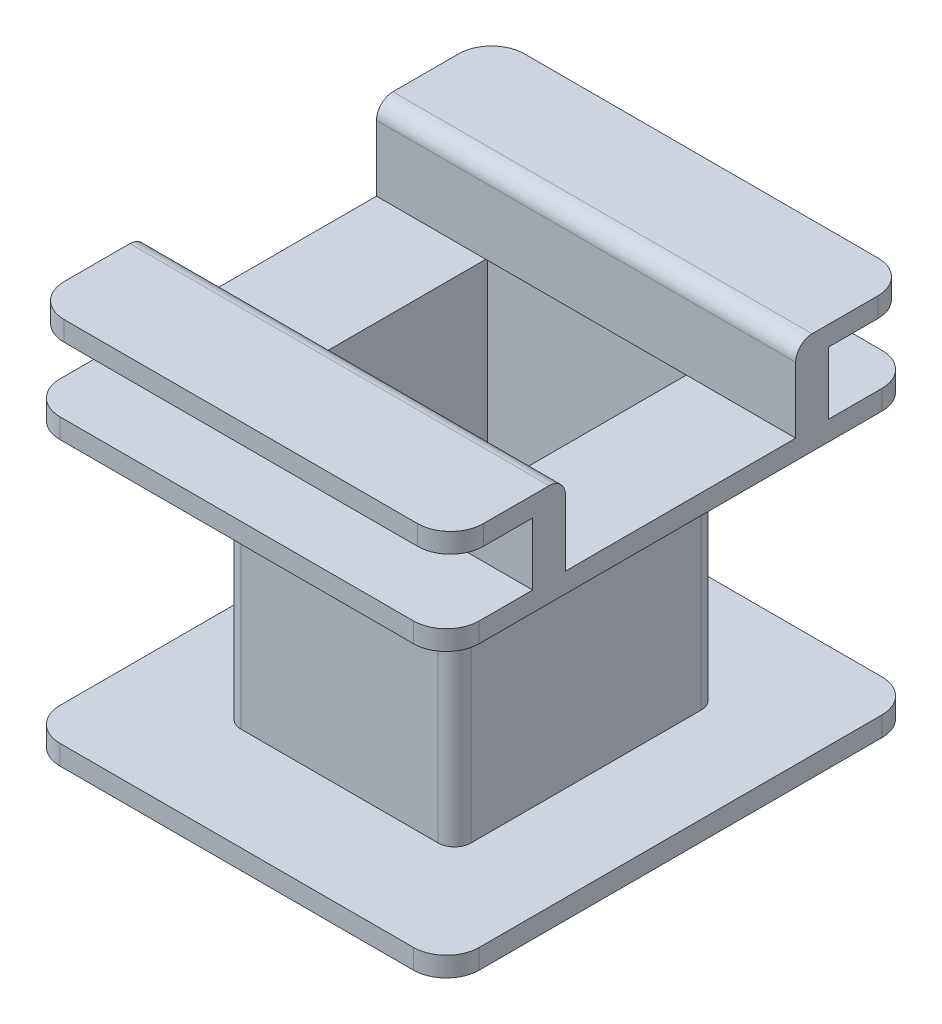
SolidWorks part; units mm, degrees
ref_plane "Спереди" through (0, 0, 0) normal (0, 0, 1) x (1, 0, 0)
ref_plane "Сверху" through (0, 0, 0) normal (0, 1, 0) x (1, 0, 0)
ref_plane "Справа" through (0, 0, 0) normal (1, 0, 0) x (0, 0, -1)
sketch "Sketch1" plane through (0, 0, 0) normal (0, 1, 0) x (1, 0, 0)
  line L1 (-7, 8) -> (7, 8)
  line L2 (-7, 8) -> (-7, -8)
  line L3 (-7, -8) -> (7, -8)
  line L4 (7, 8) -> (7, -8)
  line L5 (-7, 8) -> (7, -8) construction
  line L6 (-7, -8) -> (7, 8) construction
  point P0 (0, 0)
  dimension "D1" = 14
  dimension "D2" = 16
extrude "Boss-Extrude1" add sketch "Sketch1" along normal blind 16
fillet "Fillet1" radius 1 4 edges at (-7, 8, -8) (-7, 8, 8) (7, 8, -8) (7, 8, 8)
sketch "Sketch2" plane through (0, 16, 0) normal (0, 1, 0) x (1, 0, 0)
  line L1 (-6.1, 7.1) -> (6.1, 7.1)
  line L2 (-6.1, 7.1) -> (-6.1, -7.1)
  line L3 (-6.1, -7.1) -> (6.1, -7.1)
  line L4 (6.1, 7.1) -> (6.1, -7.1)
  line L5 (-6.1, 7.1) -> (6.1, -7.1) construction
  line L6 (-6.1, -7.1) -> (6.1, 7.1) construction
  point P0 (0, 0)
  dimension "D1" = 12.2
  dimension "D2" = 14.2
extrude "Cut-Extrude1" cut sketch "Sketch2" against normal through all both and the other way through all
sketch "Sketch3" plane through (0, 16, 0) normal (0, 1, 0) x (1, 0, 0)
  line L1 (-12.75, 14.25) -> (12.75, 14.25)
  line L2 (-12.75, 14.25) -> (-12.75, -14.25)
  line L3 (-12.75, -14.25) -> (12.75, -14.25)
  line L4 (12.75, 14.25) -> (12.75, -14.25)
  line L5 (-12.75, 14.25) -> (12.75, -14.25) construction
  line L6 (-12.75, -14.25) -> (12.75, 14.25) construction
  point P0 (0, 0)
  dimension "D1" = 28.5
  dimension "D2" = 25.5
extrude "Boss-Extrude2" add sketch "Sketch3" along normal blind 1.2
fillet "Fillet2" radius 2 4 edges at (12.75, 16.6, -14.25) (12.75, 16.6, 14.25) (-12.75, 16.6, -14.25) (-12.75, 16.6, 14.25)
sketch "Sketch4" plane through (0, 0, 0) normal (0, -1, 0) x (1, 0, 0)
  line L1 (-12.75, 14.25) -> (12.75, 14.25)
  line L2 (-12.75, 14.25) -> (-12.75, -14.25)
  line L3 (-12.75, -14.25) -> (12.75, -14.25)
  line L4 (12.75, 14.25) -> (12.75, -14.25)
  line L5 (-12.75, 14.25) -> (12.75, -14.25) construction
  line L6 (-12.75, -14.25) -> (12.75, 14.25) construction
  point P0 (0, 0)
  dimension "D1" = 25.5
  dimension "D2" = 28.5
extrude "Boss-Extrude3" add sketch "Sketch4" along normal blind 1.2
fillet "Fillet3" radius 2 4 edges at (-12.75, -0.6, 14.25) (-12.75, -0.6, -14.25) (12.75, -0.6, -14.25) (12.75, -0.6, 14.25)
sketch "Sketch5" plane through (0, -1.2, 0) normal (0, -1, 0) x (1, 0, 0)
  line L1 (-6.1, 7.1) -> (6.1, 7.1)
  line L2 (-6.1, 7.1) -> (-6.1, -7.1)
  line L3 (-6.1, -7.1) -> (6.1, -7.1)
  line L4 (6.1, 7.1) -> (6.1, -7.1)
  line L5 (-6.1, 7.1) -> (6.1, -7.1) construction
  line L6 (-6.1, -7.1) -> (6.1, 7.1) construction
  point P0 (0, 0)
extrude "Cut-Extrude2" cut sketch "Sketch5" against normal through all both and the other way through all
sketch "Sketch6" plane through (0, 17.2, 0) normal (0, 1, 0) x (1, 0, 0)
  line L0 (-12.75, 12.25) -> (-12.75, -12.25) construction
  line L1 (-12.75, -7) -> (12.75, -7)
  line L2 (-12.75, -7) -> (-12.75, -8.9989)
  line L3 (-12.75, -8.9989) -> (12.75, -8.9989)
  line L4 (12.75, -7) -> (12.75, -8.9989)
  line L5 (12.75, -12.25) -> (12.75, 12.25) construction
extrude "Boss-Extrude4" add sketch "Sketch6" along normal blind 5
sketch "Sketch7" plane through (0, 0, 8.9989) normal (0, 0, 1) x (1, 0, 0)
  line L0 (12.75, 22.2) -> (12.75, 17.2) construction
  line L1 (-12.75, 22.2) -> (12.75, 22.2)
  line L2 (-12.75, 22.2) -> (-12.75, 21)
  line L3 (-12.75, 21) -> (12.75, 21)
  line L4 (12.75, 22.2) -> (12.75, 21)
  dimension "D1" = 1.2
extrude "Boss-Extrude5" add sketch "Sketch7" along normal blind 5
fillet "Fillet4" radius 2 2 edges at (-12.75, 21.6, 13.9989) (12.75, 21.6, 13.9989)
sketch "Sketch8" plane through (0, 17.2, 0) normal (0, 1, 0) x (1, 0, 0)
  line L0 (-12.75, 12.25) -> (-12.75, -7) construction
  line L1 (-12.75, 7) -> (12.75, 7)
  line L2 (-12.75, 7) -> (-12.75, 8.9973)
  line L3 (-12.75, 8.9973) -> (12.75, 8.9973)
  line L4 (12.75, 7) -> (12.75, 8.9973)
  line L5 (12.75, -7) -> (12.75, 12.25) construction
extrude "Boss-Extrude6" add sketch "Sketch8" along normal blind 5
sketch "Sketch9" plane through (0, 0, -8.9973) normal (0, 0, -1) x (-1, 0, 0)
  line L0 (12.75, 22.2) -> (12.75, 17.2) construction
  line L1 (-12.75, 22.2) -> (12.75, 22.2)
  line L2 (-12.75, 22.2) -> (-12.75, 21)
  line L3 (-12.75, 21) -> (12.75, 21)
  line L4 (12.75, 22.2) -> (12.75, 21)
  dimension "D1" = 1.2
extrude "Boss-Extrude7" add sketch "Sketch9" along normal blind 5
fillet "Fillet5" radius 2 2 edges at (-12.75, 21.6, -13.9973) (12.75, 21.6, -13.9973)
fillet "Fillet6" radius 1 2 edges at (0, 22.2, -7) (0, 22.2, 7)
